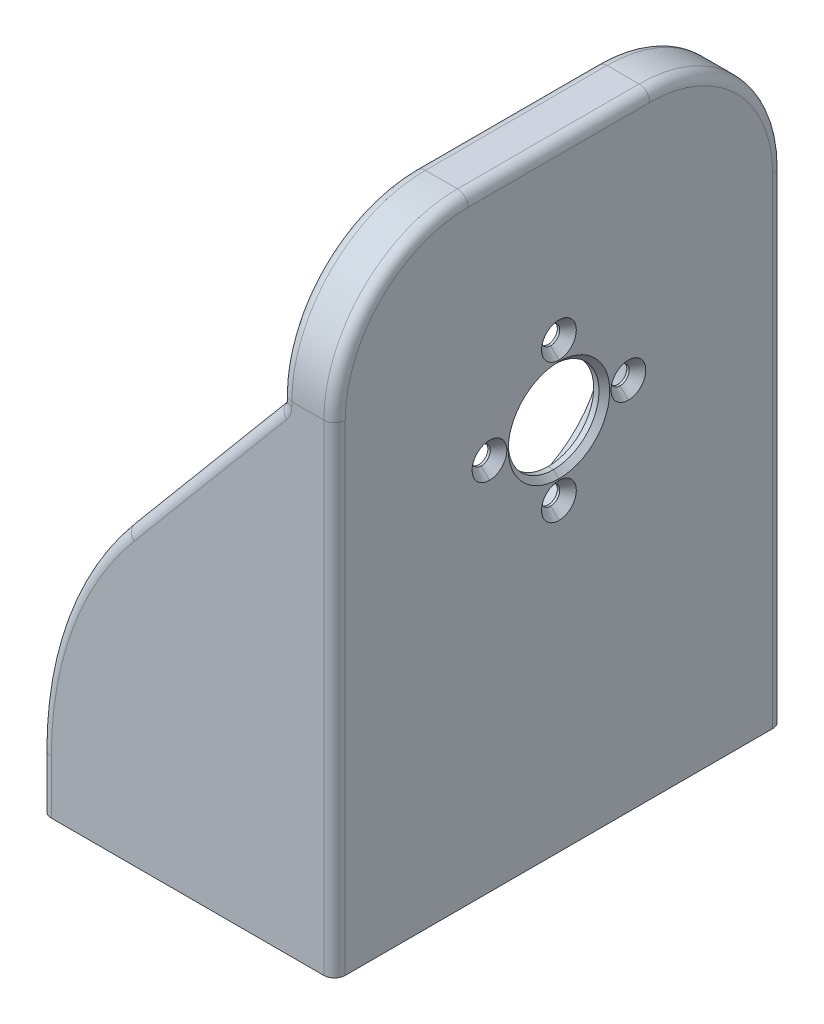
SolidWorks part; units mm, degrees
other "GEO198149"
ref_plane "Plan de face" through (0, 0, 0) normal (0, 0, 1) x (1, 0, 0)
ref_plane "Plan de dessus" through (0, 0, 0) normal (0, 1, 0) x (1, 0, 0)
ref_plane "Plan de droite" through (0, 0, 0) normal (1, 0, 0) x (0, 0, -1)
imported_body "Importée1"
sketch "Esquisse1" plane through (5, 0, 0) normal (1, 0, 0) x (0, 0, -1)
  line L4 (-40, -70) -> (40, -70)
  line L5 (40, -70) -> (40, 20)
  line L6 (17, 43) -> (-17, 43)
  line L7 (-40, 20) -> (-40, -70)
  line L8 (-40, -70) -> (40, -70)
  line L9 (40, -70) -> (40, 20)
  line L10 (17, 43) -> (-17, 43)
  line L11 (-40, 20) -> (-40, -70)
  circle A0 centre (0, 0) radius 20
  arc A2 (40, 20) -> (17, 43) centre (17, 20) ccw
  arc A3 (-17, 43) -> (-40, 20) centre (-17, 20) ccw
  arc A4 (40, 20) -> (17, 43) centre (17, 20) ccw
  arc A5 (-17, 43) -> (-40, 20) centre (-17, 20) ccw
  dimension "D2" = 40
  dimension "D1" = 0
extrude "Boss.-Extru.1" add sketch "Esquisse1" against normal blind 2
sketch "Esquisse2" plane through (0, 0, 42) normal (0, 0, 1) x (1, 0, 0)
  line L6 (3, 20) -> (-3, 20)
  line L7 (-3, 20) -> (-3, 19.2279)
  line L8 (-3.9358, 16.6568) -> (-32.4811, -17.3621)
  line L9 (-48, -60) -> (-48, -70)
  line L10 (-48, -70) -> (3, -70)
  line L11 (3, -70) -> (3, 20)
  line L12 (3, 20) -> (-3, 20)
  line L13 (-3, 20) -> (-3, 19.2279)
  line L14 (-3.9358, 16.6568) -> (-32.4811, -17.3621)
  line L15 (-48, -60) -> (-48, -70)
  line L16 (-48, -70) -> (3, -70)
  line L17 (3, -70) -> (3, 20)
  arc A2 (-3.9358, 16.6568) -> (-3, 19.2279) centre (-7, 19.2279) ccw
  arc A3 (-32.4811, -17.3621) -> (-48, -60) centre (18.3328, -60) ccw
  arc A4 (-3.9358, 16.6568) -> (-3, 19.2279) centre (-7, 19.2279) ccw
  arc A5 (-32.4811, -17.3621) -> (-48, -60) centre (18.3328, -60) ccw
  dimension "D1" = 0
extrude "Boss.-Extru.2" add sketch "Esquisse2" against normal blind 2
sketch "Esquisse3" plane through (0, -60, 0) normal (0, 1, 0) x (1, 0, 0)
  line L1 (-14.0073, 39.4943) -> (-5.8442, 39.4943)
  line L2 (-14.0073, 39.4943) -> (-14.0073, -3.6378)
  line L3 (-14.0073, -3.6378) -> (-5.8442, -3.6378)
  line L12 (-5.8442, 39.4943) -> (-5.8442, -3.6378)
extrude "Boss.-Extru.3" add sketch "Esquisse3" against normal blind 2
